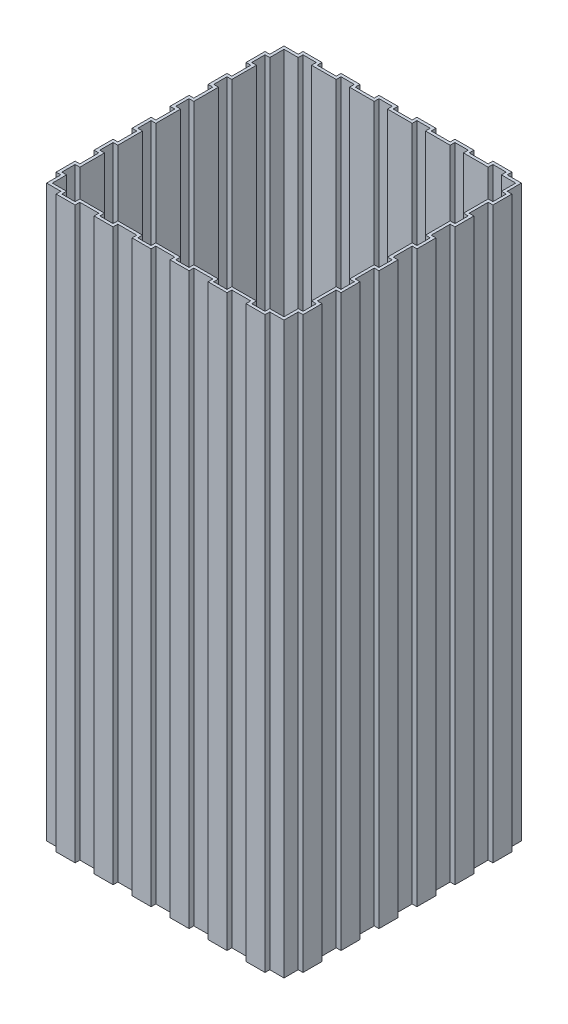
SolidWorks part; units mm, degrees
ref_plane "Front Plane" through (0, 0, 0) normal (0, 0, 1) x (1, 0, 0)
ref_plane "Top Plane" through (0, 0, 0) normal (0, 1, 0) x (1, 0, 0)
ref_plane "Right Plane" through (0, 0, 0) normal (1, 0, 0) x (0, 0, -1)
sketch "Sketch1" plane through (0, 0, 0) normal (0, 1, 0) x (1, 0, 0)
  line L1 (-25, -25) -> (25, -25)
  line L2 (-25, -25) -> (-25, 25)
  line L3 (-25, 25) -> (25, 25)
  line L4 (25, -25) -> (25, 25)
  line L5 (-25, -25) -> (25, 25) construction
  line L6 (-25, 25) -> (25, -25) construction
  circle A0 centre (0, 0) radius 25 construction
  dimension "D1" = 50
extrude "Boss-Extrude1" add sketch "Sketch1" along normal blind 120
sketch "Sketch2" plane through (0, 0, 0) normal (0, 1, 0) x (1, 0, 0)
  line L1 (25, -22) -> (26, -22)
  line L2 (25, -22) -> (25, -18)
  line L3 (25, -18) -> (26, -18)
  line L4 (26, -22) -> (26, -18)
  line L5 (25, -25) -> (25, 25) construction
  line L6 (-25, -25) -> (25, -25) construction
  line L7 (25, -14) -> (26, -14)
  line L8 (25, -14) -> (25, -10)
  line L9 (25, -10) -> (26, -10)
  line L10 (26, -14) -> (26, -10)
  line L11 (25, -6) -> (26, -6)
  line L12 (25, -6) -> (25, -2)
  line L13 (25, -2) -> (26, -2)
  line L14 (26, -6) -> (26, -2)
  line L15 (25, 2) -> (26, 2)
  line L16 (25, 2) -> (25, 6)
  line L17 (25, 6) -> (26, 6)
  line L18 (26, 2) -> (26, 6)
  line L19 (25, 10) -> (26, 10)
  line L20 (25, 10) -> (25, 14)
  line L21 (25, 14) -> (26, 14)
  line L22 (26, 10) -> (26, 14)
  line L23 (25, 18) -> (26, 18)
  line L24 (25, 18) -> (25, 22)
  line L25 (25, 22) -> (26, 22)
  line L26 (26, 18) -> (26, 22)
  line L27 (25, -22) -> (25, -14) construction
  line L28 (-22, -25) -> (-22, -26)
  line L29 (-22, -25) -> (-18, -25)
  line L30 (-18, -25) -> (-18, -26)
  line L31 (-22, -26) -> (-18, -26)
  line L32 (-14, -25) -> (-14, -26)
  line L33 (-14, -25) -> (-10, -25)
  line L34 (-10, -25) -> (-10, -26)
  line L35 (-14, -26) -> (-10, -26)
  line L36 (-6, -25) -> (-6, -26)
  line L37 (-6, -25) -> (-2, -25)
  line L38 (-2, -25) -> (-2, -26)
  line L39 (-6, -26) -> (-2, -26)
  line L40 (2, -25) -> (2, -26)
  line L41 (2, -25) -> (6, -25)
  line L42 (6, -25) -> (6, -26)
  line L43 (2, -26) -> (6, -26)
  line L44 (10, -25) -> (10, -26)
  line L45 (10, -25) -> (14, -25)
  line L46 (14, -25) -> (14, -26)
  line L47 (10, -26) -> (14, -26)
  line L48 (18, -25) -> (18, -26)
  line L49 (18, -25) -> (22, -25)
  line L50 (22, -25) -> (22, -26)
  line L51 (18, -26) -> (22, -26)
  line L52 (-22, -25) -> (-14, -25) construction
  line L53 (-25, 22) -> (-26, 22)
  line L54 (-25, 22) -> (-25, 18)
  line L55 (-25, 18) -> (-26, 18)
  line L56 (-26, 22) -> (-26, 18)
  line L57 (-25, 14) -> (-26, 14)
  line L58 (-25, 14) -> (-25, 10)
  line L59 (-25, 10) -> (-26, 10)
  line L60 (-26, 14) -> (-26, 10)
  line L61 (-25, 6) -> (-26, 6)
  line L62 (-25, 6) -> (-25, 2)
  line L63 (-25, 2) -> (-26, 2)
  line L64 (-26, 6) -> (-26, 2)
  line L65 (-25, -2) -> (-26, -2)
  line L66 (-25, -2) -> (-25, -6)
  line L67 (-25, -6) -> (-26, -6)
  line L68 (-26, -2) -> (-26, -6)
  line L69 (-25, -10) -> (-26, -10)
  line L70 (-25, -10) -> (-25, -14)
  line L71 (-25, -14) -> (-26, -14)
  line L72 (-26, -10) -> (-26, -14)
  line L73 (-25, -18) -> (-26, -18)
  line L74 (-25, -18) -> (-25, -22)
  line L75 (-25, -22) -> (-26, -22)
  line L76 (-26, -18) -> (-26, -22)
  line L77 (-25, 22) -> (-25, 14) construction
  line L78 (22, 25) -> (22, 26)
  line L79 (22, 25) -> (18, 25)
  line L80 (18, 25) -> (18, 26)
  line L81 (22, 26) -> (18, 26)
  line L82 (14, 25) -> (14, 26)
  line L83 (14, 25) -> (10, 25)
  line L84 (10, 25) -> (10, 26)
  line L85 (14, 26) -> (10, 26)
  line L86 (6, 25) -> (6, 26)
  line L87 (6, 25) -> (2, 25)
  line L88 (2, 25) -> (2, 26)
  line L89 (6, 26) -> (2, 26)
  line L90 (-2, 25) -> (-2, 26)
  line L91 (-2, 25) -> (-6, 25)
  line L92 (-6, 25) -> (-6, 26)
  line L93 (-2, 26) -> (-6, 26)
  line L94 (-10, 25) -> (-10, 26)
  line L95 (-10, 25) -> (-14, 25)
  line L96 (-14, 25) -> (-14, 26)
  line L97 (-10, 26) -> (-14, 26)
  line L98 (-18, 25) -> (-18, 26)
  line L99 (-18, 25) -> (-22, 25)
  line L100 (-22, 25) -> (-22, 26)
  line L101 (-18, 26) -> (-22, 26)
  line L102 (22, 25) -> (14, 25) construction
  point P112 (0, 0)
  dimension "D1" = 1
  dimension "D2" = 4
  dimension "D3" = 3
  dimension "D5" = 8
  dimension "D4" = 6
  dimension "D6" = 4
extrude "Boss-Extrude2" add sketch "Sketch2" along normal blind 120
shell "Shell3" thickness 0.6
